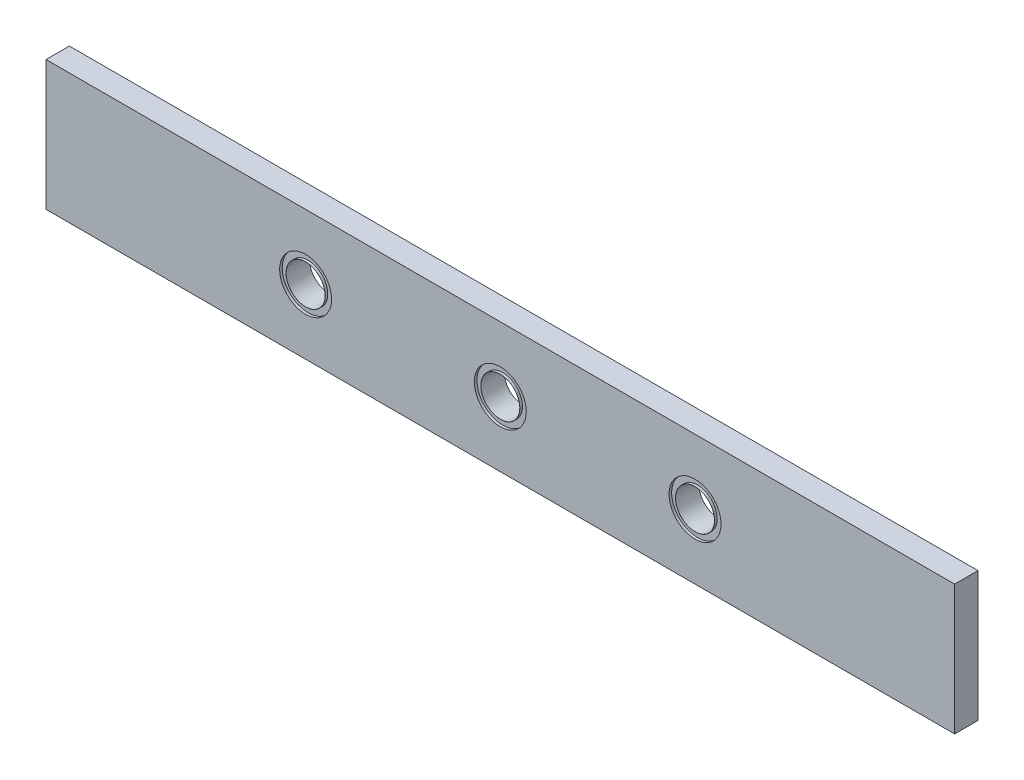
SolidWorks part; units mm, degrees
ref_plane "Front Plane" through (0, 0, 0) normal (0, 0, 1) x (1, 0, 0)
ref_plane "Top Plane" through (0, 0, 0) normal (0, 1, 0) x (1, 0, 0)
ref_plane "Right Plane" through (0, 0, 0) normal (1, 0, 0) x (0, 0, -1)
sketch "Sketch1" plane through (0, 0, 0) normal (0, 0, 1) x (1, 0, 0)
  line L1 (-350, 50) -> (350, 50)
  line L2 (-350, 50) -> (-350, -50)
  line L3 (-350, -50) -> (350, -50)
  line L4 (350, 50) -> (350, -50)
  line L5 (-350, 50) -> (350, -50) construction
  line L6 (-350, -50) -> (350, 50) construction
  point P0 (0, 0)
  dimension "D1" = 100
  dimension "D2" = 700
extrude "Boss-Extrude1" add sketch "Sketch1" along normal blind 18
sketch "Sketch2" plane through (0, 0, 18) normal (0, 0, 1) x (1, 0, 0)
  line L0 (0, 213.4344) -> (0, -279.021) construction
  line L1 (350, -50) -> (350, 50) construction
  line L2 (350, 50) -> (-350, 50) construction
  circle A0 centre (150, 0) radius 15
  circle A1 centre (-150, 0) radius 15
  dimension "D1" = 30
  dimension "D2" = 200
  dimension "D3" = 50
extrude "Cut-Extrude1" cut sketch "Sketch2" against normal through all
sketch "Sketch3" plane through (0, 0, 18) normal (0, 0, 1) x (1, 0, 0)
  circle A0 centre (0, 0) radius 15
  dimension "D1" = 30
extrude "Cut-Extrude2" cut sketch "Sketch3" against normal through all
sketch "Sketch4" plane through (0, 0, 18) normal (0, 0, 1) x (1, 0, 0)
  circle A0 centre (0, 0) radius 20
  circle A1 centre (0, 0) radius 15.05
  circle A2 centre (-150, 0) radius 20
  circle A3 centre (-150, 0) radius 15.05
  circle A4 centre (150, 0) radius 20
  circle A5 centre (150, 0) radius 15.05
  dimension "D1" = 40
  dimension "D2" = 30.1
  dimension "D3" = 30.1
  dimension "D4" = 30.1
  dimension "D5" = 40
  dimension "D6" = 40
extrude "Cut-Extrude3" cut sketch "Sketch4" against normal blind 2
ref_plane "Plane1" through (0, 0, 9) normal (0, 0, 1) x (1, 0, 0)
mirror "Mirror1" about plane through (0, 0, 9) normal (0, 0, 1) of "Cut-Extrude3"
